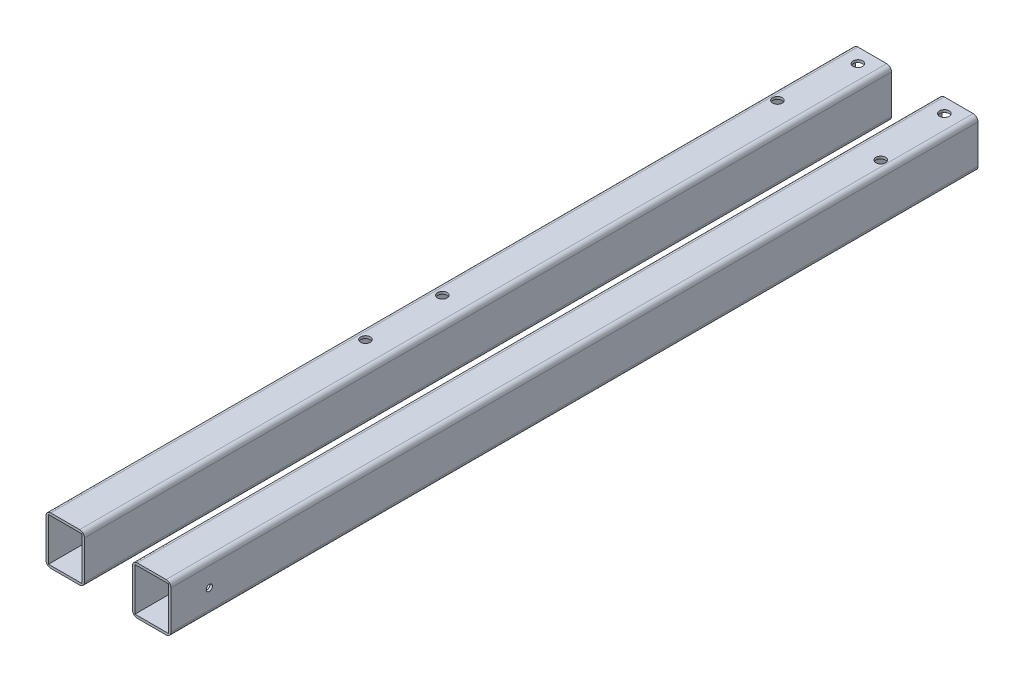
SolidWorks part; units mm, degrees
ref_plane "Front Plane" through (0, 0, 0) normal (0, 0, 1) x (1, 0, 0)
ref_plane "Top Plane" through (0, 0, 0) normal (0, 1, 0) x (1, 0, 0)
ref_plane "Right Plane" through (0, 0, 0) normal (1, 0, 0) x (0, 0, -1)
sketch "Sketch1" plane through (0, 0, 0) normal (0, 0, 1) x (1, 0, 0)
  line L0 (0, 0) -> (0, 27.54) construction
  line L1 (-41.275, 15.875) -> (-15.875, 15.875)
  line L2 (-41.275, 15.875) -> (-41.275, -15.875)
  line L3 (-41.275, -15.875) -> (-15.875, -15.875)
  line L4 (-15.875, 15.875) -> (-15.875, -15.875)
  line L5 (-41.275, 15.875) -> (-15.875, -15.875) construction
  line L6 (-41.275, -15.875) -> (-15.875, 15.875) construction
  line L7 (15.875, 15.875) -> (41.275, 15.875)
  line L8 (15.875, 15.875) -> (15.875, -15.875)
  line L9 (15.875, -15.875) -> (41.275, -15.875)
  line L10 (41.275, 15.875) -> (41.275, -15.875)
  line L11 (15.875, 15.875) -> (41.275, -15.875) construction
  line L12 (15.875, -15.875) -> (41.275, 15.875) construction
  point P0 (-28.575, 0)
  point P5 (28.575, 0)
  dimension "D1" = 25.4
  dimension "D2" = 31.75
  dimension "D3" = 31.75
extrude "Extrude-Thin1" add sketch "Sketch1" along normal blind 533.4 thin
fillet "Fillet1" radius 3.175 4 edges at (15.875, -15.875, 266.7) (41.275, -15.875, 266.7) (15.875, 15.875, 266.7) (41.275, 15.875, 266.7)
fillet "Fillet2" radius 3.175 4 edges at (-41.275, 15.875, 266.7) (-41.275, -15.875, 266.7) (-15.875, -15.875, 266.7) (-15.875, 15.875, 266.7)
sketch "Sketch2" plane through (0, 0, 0) normal (1, 0, 0) x (0, 0, -1)
  circle A0 centre (-12.7, 0) radius 3.9624
  dimension "D1" = 7.9248
  dimension "D2" = 12.7
extrude "Cut-Extrude1" [suppressed] cut sketch "Sketch2" against normal mid plane 101.6
sketch "Sketch3" plane through (0, 0, 0) normal (1, 0, 0) x (0, 0, -1)
  line L0 (-533.4, -12.7) -> (-533.4, 12.7) construction
  circle A0 centre (-508, 0) radius 2.0574
  dimension "D1" = 4.1148
  dimension "D2" = 25.4
extrude "Cut-Extrude2" cut sketch "Sketch3" along normal blind 25.4 from offset 25.4
sketch "Sketch4" plane through (0, 0, 0) normal (0, 1, 0) x (1, 0, 0)
  line L0 (0, 0) -> (0, 33.9724) construction
  circle A0 centre (28.575, -9.525) radius 3.175
  circle A1 centre (34.1376, -57.15) radius 3.175
  circle A2 centre (-28.575, -9.525) radius 3.175
  circle A3 centre (-34.1376, -57.15) radius 3.175
  dimension "D3" = 6.35
  dimension "D1" = 9.525
  dimension "D2" = 57.15
  dimension "D4" = 68.2752
  dimension "D5" = 57.15
  dimension "D6" = 47.625
extrude "Cut-Extrude3" cut sketch "Sketch4" against normal mid plane 50.8
sketch "Sketch5" plane through (0, 0, 0) normal (1, 0, 0) x (0, 0, -1)
  line L0 (-1214.3618, 0) -> (-1346.2, 0) construction
  line L1 (-1346.2, 0) -> (-1346.2, -12.7)
  line L2 (-1346.2, -12.7) -> (-533.4, -12.7)
  line L3 (-1346.2, 0) -> (-1346.2, 12.7)
  line L4 (-1346.2, 12.7) -> (-533.4, 12.7)
  line L5 (-533.4, -12.7) -> (-533.4, 12.7) construction
  dimension "D1" = 25.4
  dimension "D2" = 1346.2
sketch "Sketch6" plane through (0, 0, 0) normal (0, 1, 0) x (1, 0, 0)
  line L0 (-41.275, -533.4) -> (-41.275, 0) construction
  circle A0 centre (-33.3248, -330.2) radius 3.175
  circle A1 centre (-33.3248, -279.4) radius 3.175
  dimension "D1" = 6.35
  dimension "D2" = 33.3248
  dimension "D3" = 279.4
  dimension "D4" = 50.8
  dimension "D5" = 7.9502
extrude "Cut-Extrude4" cut sketch "Sketch6" against normal mid plane 50.8
